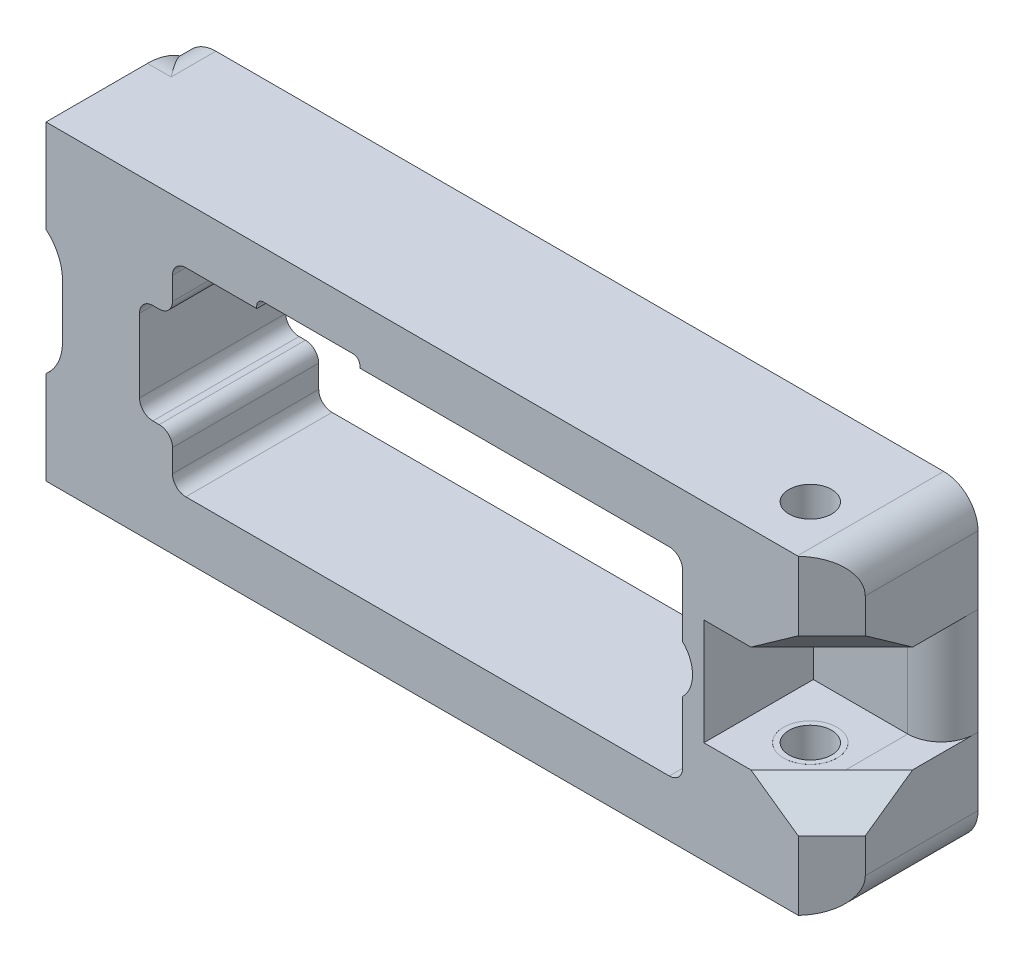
SolidWorks part; units mm, degrees
ref_plane "Front Plane" through (0, 0, 0) normal (0, 0, 1) x (1, 0, 0)
ref_plane "Top Plane" through (0, 0, 0) normal (0, 1, 0) x (1, 0, 0)
ref_plane "Right Plane" through (0, 0, 0) normal (1, 0, 0) x (0, 0, -1)
imported_body "Imported1"
imported_body "Imported2"
ref_plane "Plane1" through (0, -12.3349, 0) normal (0, 1, 0) x (1, 0, 0)
sketch "Sketch5" plane through (0, 6.2317, 0) normal (0, 1, 0) x (1, 0, 0)
  circle A0 centre (167.102, -7.4524) radius 3.1877 construction
  circle A1 centre (167.102, -7.4524) radius 3.1877
  circle A2 centre (167.102, -7.4524) radius 2.55
  dimension "D1" = 5.1
extrude "Boss-Extrude2" add sketch "Sketch5" against normal blind 12.22
sketch "Sketch6" plane through (0, -30.9015, 0) normal (0, -1, 0) x (1, 0, 0)
  line L0 (176.0243, -3.6474) -> (176.0243, 13.8151)
  line L1 (176.0243, 13.8151) -> (167.102, 13.8151)
  line L3 (172.028, -3.6474) -> (174.2591, -3.6474) construction
  line L6 (172.0324, 0.7413) -> (172.0324, 8.0159) construction
  line L8 (172.028, -3.6474) -> (176.0243, -3.6474)
  line L11 (172.0324, -3.6474) -> (172.0324, 8.0159)
  arc A0 (172.0324, 8.0159) -> (167.102, 13.8151) centre (166.1567, 8.0159) ccw construction
  arc A1 (172.0324, 8.0159) -> (167.102, 13.8151) centre (166.1567, 8.0159) ccw
  arc A2 (176.0054, -3.6474) -> (172.0324, 0.7413) centre (172.0243, -3.2587) ccw construction
extrude "Boss-Extrude3" add sketch "Sketch6" against normal blind 12.22 contours L11 L8 L0 L1 M9 M8
mirror "Mirror2" about plane through (0, -12.3349, 0) normal (0, 1, 0) of "Boss-Extrude3", "Boss-Extrude2"
chamfer "Chamfer1" distance 4 angle 45 2 edges at (176.0243, -24.7915, 13.8151) (176.0243, 0.1217, 13.8151)
chamfer "Chamfer2" distance 4 angle 45 2 edges at (174.0243, -5.9883, 11.8151) (174.0243, -18.6815, 11.8151)
sketch "Sketch7" plane through (0, -30.9015, 0) normal (0, -1, 0) x (1, 0, 0)
  line L0 (84.7884, -3.6474) -> (82.199, -3.6474) construction
  line L1 (82.199, 13.8151) -> (79.3063, 13.8151)
  line L2 (82.199, 13.8151) -> (82.199, -3.6474)
  line L3 (82.199, -3.6474) -> (79.3063, -3.6474)
  line L4 (79.3063, 13.8151) -> (79.3063, -3.6474)
extrude "Cut-Extrude4" cut sketch "Sketch7" against normal through all
fillet "Fillet1" radius 4.1 2 edges at (176.0243, -30.9015, 3.0839) (176.0243, 6.2317, 3.0839)
